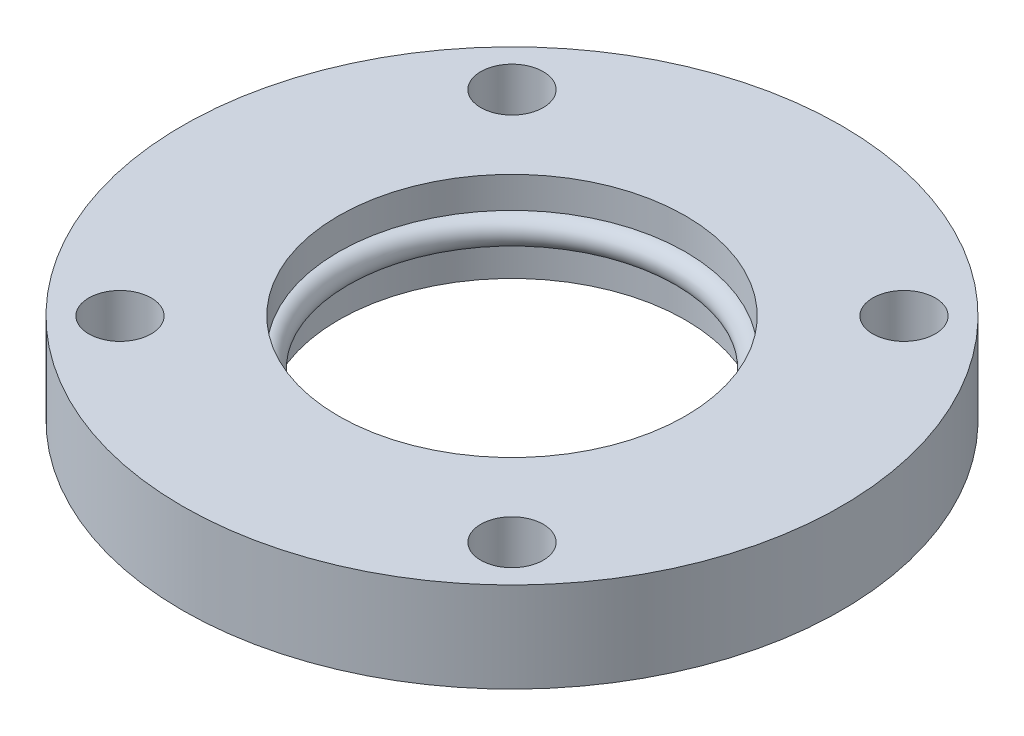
SolidWorks part; units mm, degrees
ref_plane "Front Plane" through (0, 0, 0) normal (0, 0, 1) x (1, 0, 0)
ref_plane "Top Plane" through (0, 0, 0) normal (0, 1, 0) x (1, 0, 0)
ref_plane "Right Plane" through (0, 0, 0) normal (1, 0, 0) x (0, 0, -1)
sketch "Sketch2" plane through (0, 0, 0) normal (0, 1, 0) x (1, 0, 0)
  line L1 (-28.25, -28.25) -> (28.25, -28.25) construction
  line L2 (-28.25, -28.25) -> (-28.25, 28.25) construction
  line L3 (-28.25, 28.25) -> (28.25, 28.25) construction
  line L4 (28.25, -28.25) -> (28.25, 28.25) construction
  line L5 (-28.25, -28.25) -> (28.25, 28.25) construction
  line L6 (-28.25, 28.25) -> (28.25, -28.25) construction
  circle A0 centre (0, 0) radius 25
  circle A1 centre (0, 0) radius 47.5
  circle A2 centre (-28.25, 28.25) radius 4.5
  circle A3 centre (28.25, 28.25) radius 4.5
  circle A4 centre (28.25, -28.25) radius 4.5
  circle A5 centre (-28.25, -28.25) radius 4.5
  dimension "D1" = 95
  dimension "D2" = 50
  dimension "D4" = 9
  dimension "D3" = 56.5
extrude "Boss-Extrude1" add sketch "Sketch2" along normal mid plane 13
sketch "Sketch3" plane through (0, 0, 0) normal (0, 0, 1) x (1, 0, 0)
  line L0 (-25, 0) -> (0, 0) construction
  line L1 (0, 0) -> (0, 6.5) construction
  line L2 (47.5, 6.5) -> (-47.5, 6.5) construction
  circle A0 centre (-25, 0) radius 2
  dimension "D1" = 4
  dimension "D2" = 50
revolve "Revolve2" add sketch "Sketch3" angle 360 about L1
